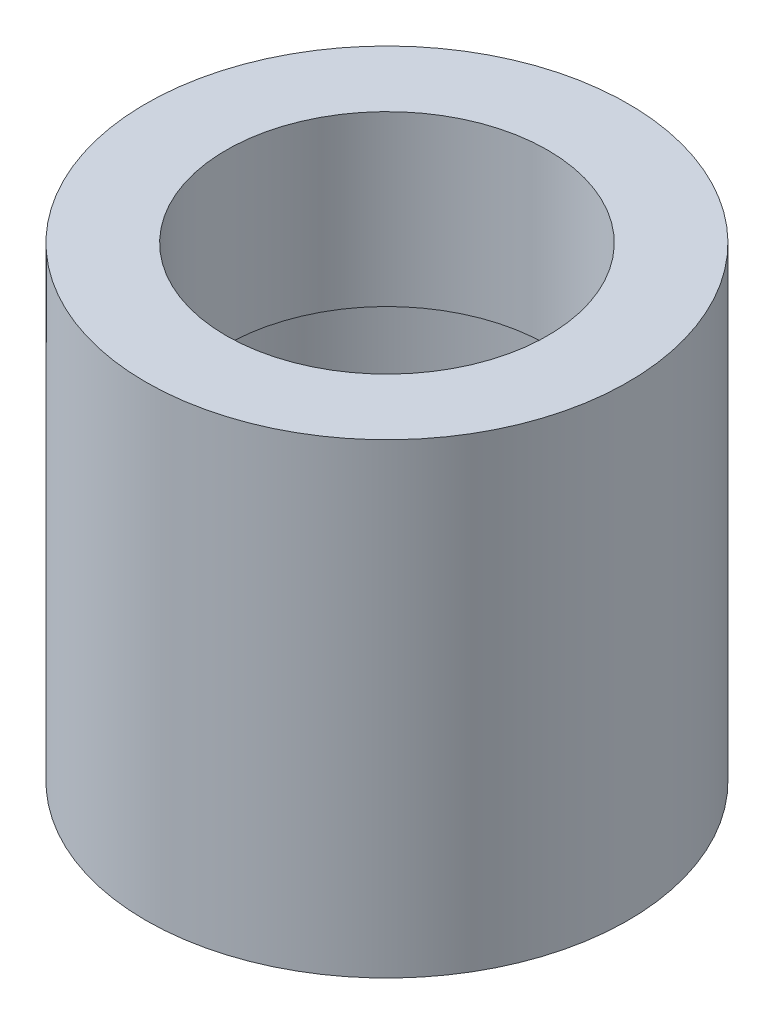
SolidWorks part; units mm, degrees
ref_plane "Front Plane" through (0, 0, 0) normal (0, 0, 1) x (1, 0, 0)
ref_plane "Top Plane" through (0, 0, 0) normal (0, 1, 0) x (1, 0, 0)
ref_plane "Right Plane" through (0, 0, 0) normal (1, 0, 0) x (0, 0, -1)
sketch "Sketch1" plane through (0, 0, 0) normal (0, 1, 0) x (1, 0, 0)
  circle A0 centre (0, 0) radius 15
  circle A1 centre (0, 0) radius 13
  dimension "D1" = 26
  dimension "D2" = 30
extrude "Boss-Extrude1" add sketch "Sketch1" against normal mid plane 29
sketch "Sketch3" plane through (0, 14.5, 0) normal (0, 1, 0) x (1, 0, 0)
  circle A0 centre (0, 0) radius 13
  circle A1 centre (0, 0) radius 10
  dimension "D1" = 20
extrude "Boss-Extrude2" add sketch "Sketch3" against normal blind 10.5
